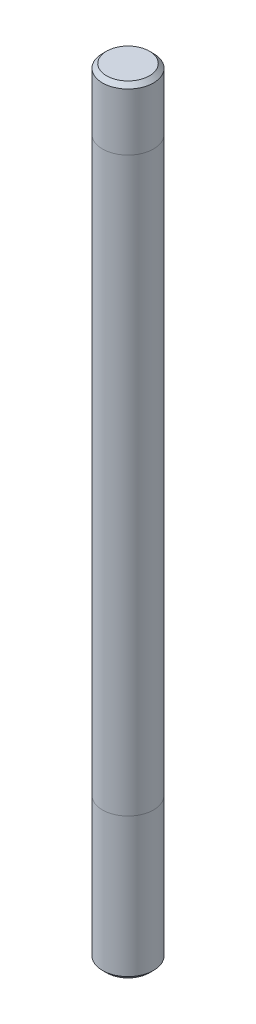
SolidWorks part; units mm, degrees
ref_plane "Front" through (0, 0, 0) normal (0, 0, 1) x (1, 0, 0)
ref_plane "Top" through (0, 0, 0) normal (0, 1, 0) x (1, 0, 0)
ref_plane "Right" through (0, 0, 0) normal (1, 0, 0) x (0, 0, -1)
sketch "Sketch1" plane through (0, 0, 0) normal (0, 1, 0) x (1, 0, 0)
  circle A0 centre (0, 0) radius 2.5
extrude "Extrude1" add sketch "Sketch1" along normal blind 56
sketch "Sketch2" plane through (0, 56, 0) normal (0, 1, 0) x (-1, 0, 0)
  circle A0 centre (0, 0) radius 2.495
extrude "Extrude2" add sketch "Sketch2" along normal blind 6
sketch "Sketch3" plane through (0, 0, 0) normal (0, -1, 0) x (1, 0, 0)
  circle A0 centre (0, 0) radius 2.495
extrude "Extrude3" add sketch "Sketch3" along normal blind 14
chamfer "Chamfer1" distance 0.4 angle 45 1 edges at (0, 62, 2.495)
chamfer "Chamfer2" distance 0.4 angle 45 1 edges at (0, -14, -2.495)
